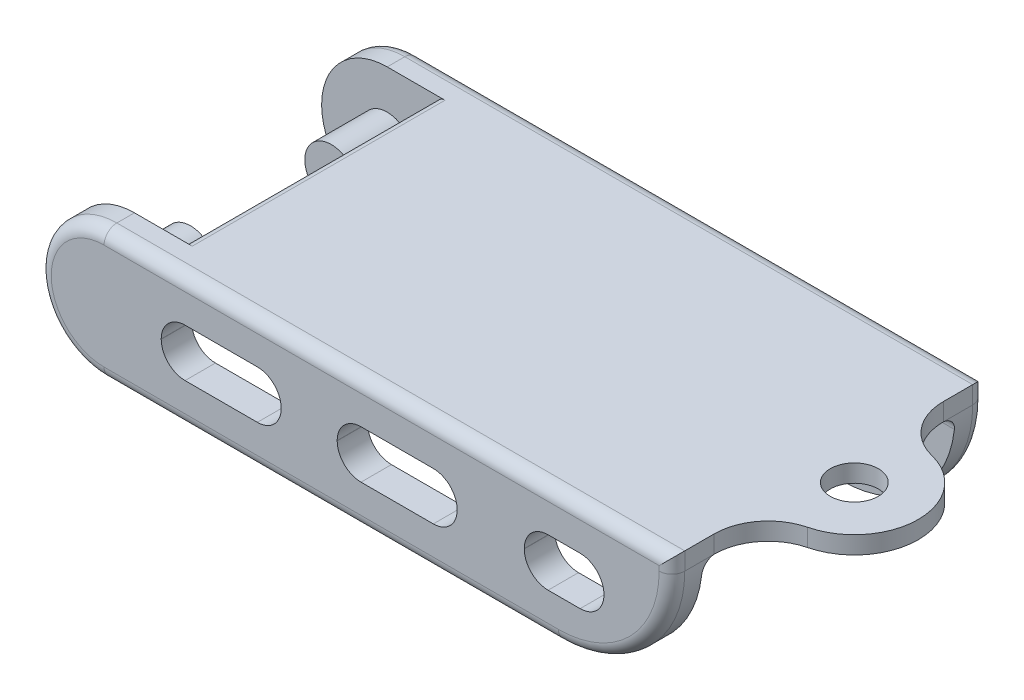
SolidWorks part; units mm, degrees
ref_plane "Plan de face" through (0, 0, 0) normal (0, 0, 1) x (1, 0, 0)
ref_plane "Plan de dessus" through (0, 0, 0) normal (0, 1, 0) x (1, 0, 0)
ref_plane "Plan de droite" through (0, 0, 0) normal (1, 0, 0) x (0, 0, -1)
sketch "Esquisse1" plane through (0, 0, 0) normal (0, 0, 1) x (1, 0, 0)
  line L0 (-26.893, 0) -> (0.9816, 0) construction
  line L1 (0, 23.3763) -> (0, -28.3411) construction
  line L2 (0, -4.1) -> (28.2491, -4.1) construction
  line L3 (0, 4.1) -> (38.3372, 4.1) construction
  line L4 (2.2491, 2.6) -> (39.4664, 2.6) construction
  line L5 (1.2823, -3.1) -> (28.2491, -3.1) construction
  line L6 (0, 4.1) -> (35.5, 4.1)
  line L7 (3.5, 1.3432) -> (3.5, -4.1096) construction
  line L8 (25.5, 1.3432) -> (25.5, -13.5069) construction
  line L9 (2.5971, 1.6) -> (38.3372, 1.6) construction
  line L10 (35.5, 4.1) -> (35.5, 3)
  line L11 (35.5, 3) -> (2.7946, 3)
  line L13 (1.5921, 3) -> (40.7284, 3) construction
  line L14 (35.5, 9.1268) -> (35.5, -17.0221) construction
  circle A0 centre (0, 0) radius 1.8 construction
  circle A1 centre (0, 0) radius 2 construction
  circle A2 centre (0, 0) radius 4.1 construction
  arc A3 (0, 4.1) -> (2.7946, 3) centre (0, 0) ccw
  dimension "D1" = 1.5
  dimension "D3" = 3.5
  dimension "D6" = 1
  dimension "D7" = 1.1
  dimension "D2" = 1
  dimension "D4" = 22
  dimension "D5" = 4.7
  dimension "D8" = 10
extrude "Boss.-Extru.1" add sketch "Esquisse1" along normal blind 19.6
sketch "Esquisse2" plane through (0, 3, 0) normal (0, -1, 0) x (1, 0, 0)
  line L0 (-4.7785, 9.8) -> (40.6163, 9.8) construction
  line L2 (24.1595, 1.9) -> (-8.1069, 1.9)
  line L3 (24.1595, 1.9) -> (24.1595, 17.7)
  line L4 (24.1595, 17.7) -> (-8.1069, 17.7)
  line L5 (-8.1069, 1.9) -> (-8.1069, 17.7)
  line L6 (24.1595, 1.9) -> (-8.1069, 17.7) construction
  line L7 (24.1595, 17.7) -> (-8.1069, 1.9) construction
  point P2 (8.0263, 9.8)
  dimension "D1" = 15.8
extrude "Enlèv. mat.-Extru.1" cut sketch "Esquisse2" along normal through all
sketch "Esquisse3" plane through (0, 0, 0) normal (0, 0, 1) x (1, 0, 0)
  circle A0 centre (0, 0) radius 1.65
extrude "Boss.-Extru.2" add sketch "Esquisse3" along normal up to surface (19.6 mm away)
sketch "Esquisse4" plane through (0, 3, 0) normal (0, -1, 0) x (1, 0, 0)
  line L0 (35.5, 9.8) -> (-6.2116, 9.8) construction
  line L1 (35.5, 19.6) -> (35.5, 0) construction
  line L2 (-4.1, 17.7) -> (4.1, 17.7) construction
  line L3 (20.0501, 5.4) -> (-7.8242, 5.4)
  line L4 (20.0501, 5.4) -> (20.0501, 14.2)
  line L5 (20.0501, 14.2) -> (-7.8242, 14.2)
  line L6 (-7.8242, 5.4) -> (-7.8242, 14.2)
  line L7 (20.0501, 5.4) -> (-7.8242, 14.2) construction
  line L8 (20.0501, 14.2) -> (-7.8242, 5.4) construction
  point P4 (6.113, 9.8)
  dimension "D1" = 3.5
extrude "Enlèv. mat.-Extru.2" cut sketch "Esquisse4" along normal blind 14
sketch "Esquisse5" plane through (0, 3, 0) normal (0, -1, 0) x (1, 0, 0)
  line L0 (-2.7946, 9.8) -> (40.0616, 9.8) construction
  line L1 (-2.7946, 17.7) -> (-2.7946, 1.9) construction
  line L2 (2.7946, 17.7) -> (37.704, 17.7) construction
  line L3 (-4.1, 17.7) -> (4.1, 17.7) construction
  line L4 (2.7946, 17.7) -> (-2.7946, 17.7) construction
  line L5 (0, 15.24) -> (0, 21.157) construction
  line L6 (35.5, 8.9069) -> (35.5, 23.2835) construction
  line L7 (35.5, 19.6) -> (35.5, 0) construction
  line L8 (-3.253, 19.6) -> (40.0616, 19.6) construction
  line L9 (4.1, 19.6) -> (-4.1, 19.6) construction
  line L10 (0, 0) -> (35.5, 0)
  line L11 (0, 17.7) -> (35.5, 17.7)
  line L12 (0, 17.7) -> (0, 19.6)
  line L13 (0, 19.6) -> (35.5, 19.6)
  line L14 (35.5, 17.7) -> (35.5, 19.6)
  line L15 (0, 1.9) -> (35.5, 1.9)
  line L16 (35.5, 1.9) -> (35.5, 0)
  line L17 (0, 1.9) -> (0, 0)
extrude "Boss.-Extru.3" add sketch "Esquisse5" along normal blind 7.1
fillet "Congé1" radius 7.1 2 edges at (35.5, -4.1, 18.65) (35.5, -4.1, 0.95)
sketch "Esquisse6" plane through (0, 3, 0) normal (0, -1, 0) x (1, 0, 0)
  line L0 (46.9505, 9.8) -> (17.418, 9.8) construction
  line L2 (33.7694, 17.7) -> (45.6162, 17.7) construction
  line L3 (28.4, 17.7) -> (35.5, 17.7) construction
  line L4 (35.5, 15.6939) -> (35.5, -0.86) construction
  line L5 (35.5, 17.7) -> (35.5, 1.9) construction
  line L6 (37.1, 19.2637) -> (37.1, 5.2371) construction
  line L7 (35.5, 16.9654) -> (34.6845, 16.9654) construction
  line L8 (35.5, 16.9654) -> (34.3727, 16.9654)
  line L9 (34.3727, 16.9654) -> (34.3727, 2.6346)
  line L10 (35.5, 2.6346) -> (34.3727, 2.6346)
  circle A0 centre (37.1, 9.8) radius 1.5
  arc A1 (38.0665, 5.9185) -> (38.0665, 13.6815) centre (37.1, 9.8) ccw
  arc A2 (35.5, 16.9654) -> (38.0665, 13.6815) centre (38.8841, 16.9654) ccw
  arc A3 (35.5, 2.6346) -> (38.0665, 5.9185) centre (38.8841, 2.6346) cw
  point P24 (34.3727, 9.8)
  dimension "D1" = 1.6
extrude "Boss.-Extru.4" add sketch "Esquisse6" against normal up to surface (1.1 mm away)
sketch "Esquisse8" plane through (0, 0, 1.9) normal (0, 0, 1) x (1, 0, 0)
  circle A0 centre (0, 0) radius 4.6
  circle A1 centre (0, 0) radius 2.4524
extrude "Enlèv. mat.-Extru.4" cut sketch "Esquisse8" along normal up to surface (15.8 mm away)
sketch "Esquisse7" plane through (0, 3, 0) normal (0, -1, 0) x (1, 0, 0)
  text T0 "www.a4.fr" font "Arial Narrow" height 7
extrude "Enlèv. mat.-Extru.3" cut sketch "Esquisse7" against normal blind 0.5
fillet "Congé2" radius 0.5 1 edges at (2.0857, 4.1, 9.8)
fillet "Congé3" radius 0.8 10 edges at (14.2, -4.1, 19.6) (35.5, 3.55, 19.6) (33.4205, -2.0205, 19.6) (35.5, 3.55, 0) (33.4205, -2.0205, 0) (17.75, 4.1, 19.6) (-4.1, 0, 19.6) (17.75, 4.1, 0) (-4.1, 0, 0) (14.2, -4.1, 0)
sketch "Esquisse9" plane through (0, 0, 0) normal (0, 1, 0) x (1, 0, 0)
  line L0 (24, -24.1616) -> (24, 4.5722) construction
  line L1 (0, -17.7) -> (0, -1.9) construction
  line L2 (20.7225, -17.7) -> (28.025, -17.7) construction
  line L3 (0, -17.7) -> (28.4, -17.7) construction
  line L4 (35.5, -17.7) -> (3.4871, -17.7) construction
  line L5 (37.1, -9.8) -> (-8.0642, -9.8) construction
  line L6 (24, -18.3) -> (24, -17.1)
  line L7 (24, -1.3) -> (24, -2.5)
  arc A0 (24, -17.1) -> (24, -18.3) centre (24, -17.7) ccw
  arc A1 (24, -2.5) -> (24, -1.3) centre (24, -1.9) cw
  dimension "D1" = 24
revolve "Enlèvement de matière-Révolution1" cut sketch "Esquisse9" angle 360 about L0
fillet "Congé4" radius 0.8 2 edges at (19.4936, 3, 1.9) (19.4936, 3, 17.7)
sketch "Esquisse11" plane through (0, 0, 0) normal (0, 0, 1) x (1, 0, 0)
  line L0 (-0.8956, 0) -> (48.6532, 0) construction
  line L1 (16.0627, -1.5) -> (20.5827, -1.5)
  line L2 (5.0627, -1.5) -> (9.5827, -1.5)
  line L3 (3.5727, -0.01) -> (3.5727, 0.01)
  line L4 (5.0627, 1.5) -> (9.5827, 1.5)
  line L5 (11.0727, -0.01) -> (11.0727, 0.01)
  line L6 (3.5727, -1.5) -> (11.0727, 1.5) construction
  line L7 (3.5727, 1.5) -> (11.0727, -1.5) construction
  line L8 (14.5727, -0.01) -> (14.5727, 0.01)
  line L9 (16.0627, 1.5) -> (20.5827, 1.5)
  line L10 (22.0727, -0.01) -> (22.0727, 0.01)
  line L12 (27.7575, -1.5) -> (29.7575, -1.5)
  line L13 (26.2675, -0.01) -> (26.2675, 0.01)
  line L14 (27.7575, 1.5) -> (29.7575, 1.5)
  line L15 (31.2475, -0.01) -> (31.2475, 0.01)
  line L16 (26.2675, -1.5) -> (31.2475, 1.5) construction
  line L17 (26.2675, 1.5) -> (31.2475, -1.5) construction
  arc A0 (20.5827, -1.5) -> (22.0727, -0.01) centre (20.5827, -0.01) ccw
  arc A1 (20.5827, 1.5) -> (22.0727, 0.01) centre (20.5827, 0.01) cw
  arc A2 (14.5727, 0.01) -> (16.0627, 1.5) centre (16.0627, 0.01) cw
  arc A3 (16.0627, -1.5) -> (14.5727, -0.01) centre (16.0627, -0.01) cw
  arc A4 (9.5827, -1.5) -> (11.0727, -0.01) centre (9.5827, -0.01) ccw
  arc A5 (9.5827, 1.5) -> (11.0727, 0.01) centre (9.5827, 0.01) cw
  arc A6 (3.5727, 0.01) -> (5.0627, 1.5) centre (5.0627, 0.01) cw
  arc A7 (5.0627, -1.5) -> (3.5727, -0.01) centre (5.0627, -0.01) cw
  arc A8 (26.2675, 0.01) -> (27.7575, 1.5) centre (27.7575, 0.01) cw
  arc A9 (29.7575, 1.5) -> (31.2475, 0.01) centre (29.7575, 0.01) cw
  arc A10 (29.7575, -1.5) -> (31.2475, -0.01) centre (29.7575, -0.01) ccw
  arc A11 (27.7575, -1.5) -> (26.2675, -0.01) centre (27.7575, -0.01) cw
  point P3 (7.3227, 0)
  point P32 (28.7575, 0)
  dimension "D4" = 1.49
  dimension "D6" = 1.49
  dimension "D1" = 3
  dimension "D2" = 7.5
  dimension "D5" = 3
  dimension "D7" = 2
  dimension "D3" = 2
extrude "Enlèv. mat.-Extru.6" cut sketch "Esquisse11" along normal through all
